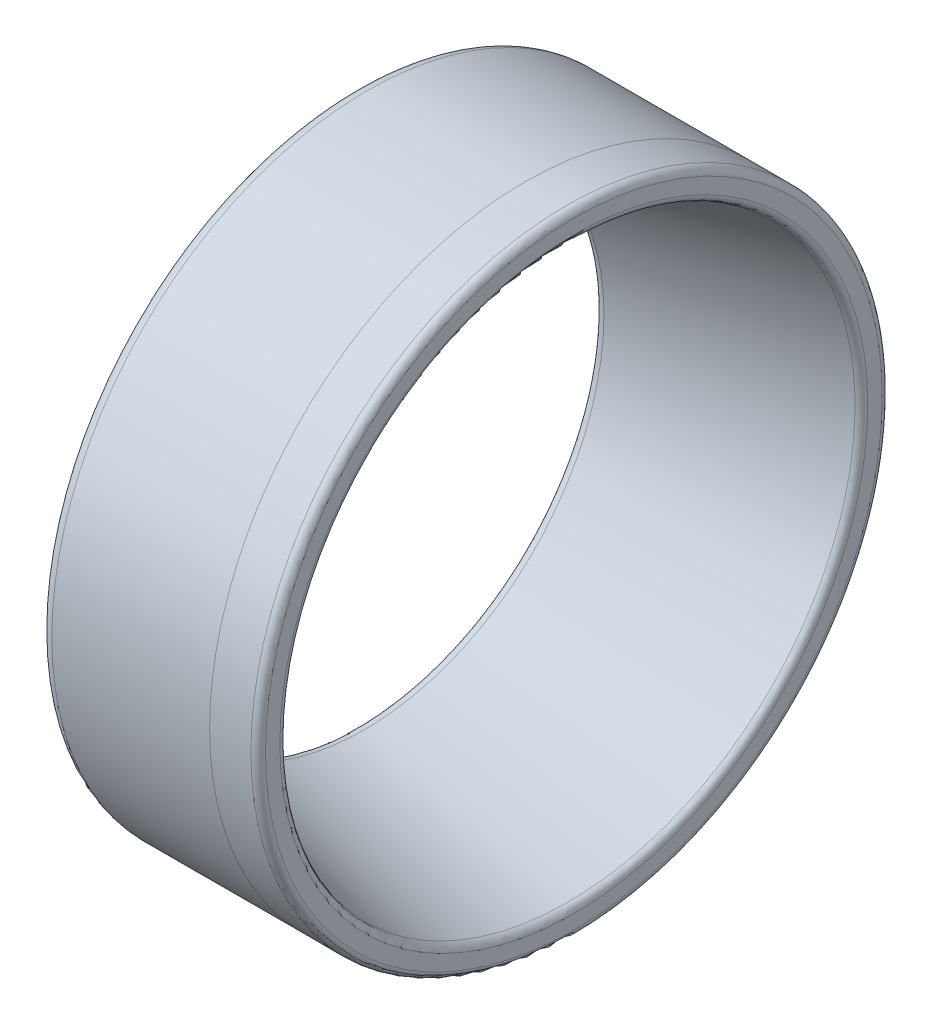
SolidWorks part; units mm, degrees
ref_plane "Plan1" through (0, 0, 0) normal (0, 0, 1) x (1, 0, 0)
ref_plane "Plan2" through (0, 0, 0) normal (0, 1, 0) x (1, 0, 0)
ref_plane "Plan3" through (0, 0, 0) normal (1, 0, 0) x (0, 0, -1)
sketch "Esquisse2" plane through (0, 0, 0) normal (0, 0, 1) x (1, 0, 0)
  line L0 (-13, 26) -> (3.4, 26)
  line L1 (4, 25.4) -> (4, 24.2125)
  line L2 (3.535, 23.6278) -> (-13.265, 19.7492)
  line L3 (-14, 20.3339) -> (-14, 25)
  line L4 (-17.9901, 0) -> (10.4363, 0) construction
  line L5 (0, 0) -> (-14, 0) construction
  line L6 (-14, 26) -> (8.25, 26) construction
  line L7 (4, 23.7352) -> (-14, 19.5796) construction
  line L8 (-14, 26) -> (-14, 10) construction
  line L10 (4, 26) -> (4, 23.7352) construction
  arc A0 (-13, 26) -> (-14, 25) centre (-13, 25) ccw
  arc A1 (-13.265, 19.7492) -> (-14, 20.3339) centre (-13.4, 20.3339) cw
  arc A2 (4, 24.2125) -> (3.535, 23.6278) centre (3.4, 24.2125) cw
  arc A3 (3.4, 26) -> (4, 25.4) centre (3.4, 25.4) cw
  point P22 (4, 23.7352)
  point P25 (4, 26)
  dimension "D4" = 1
  dimension "D6" = 0.6
revolve "Base-Révolution" add sketch "Esquisse2" angle 360 about L4
sketch "Esquisse3" plane through (0, 0, 0) normal (0, 0, 1) x (1, 0, 0)
  line L0 (0, -26) -> (0, 26)
  line L1 (-13, -26) -> (3.4, -26) construction
